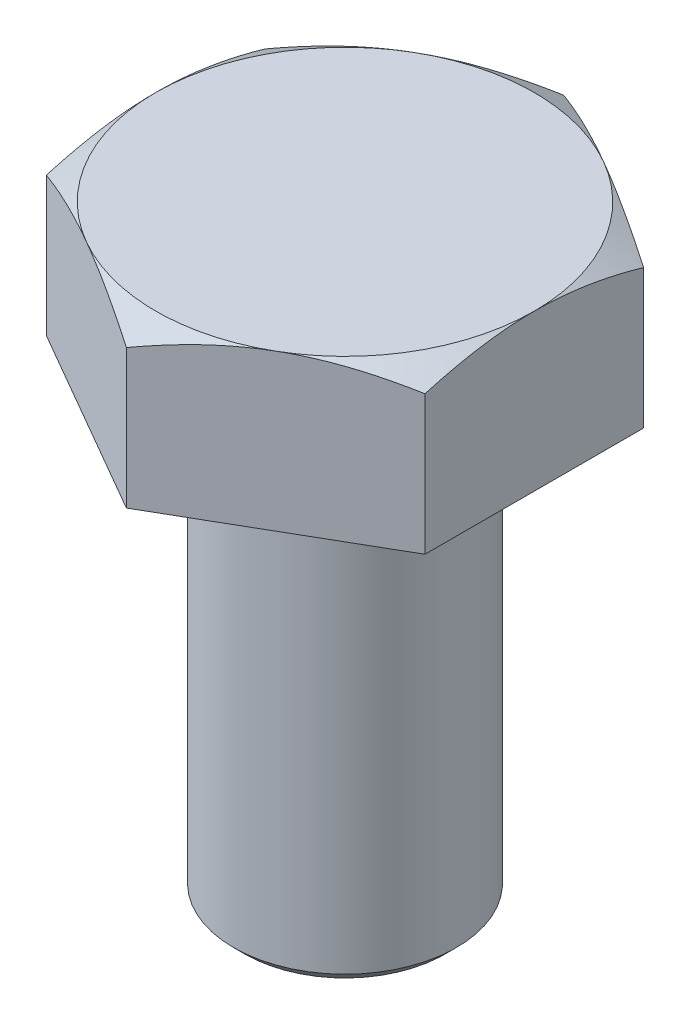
SolidWorks part; units mm, degrees
ref_plane "正面" through (0, 0, 0) normal (0, 0, 1) x (1, 0, 0)
ref_plane "平面" through (0, 0, 0) normal (0, 1, 0) x (1, 0, 0)
ref_plane "右側面" through (0, 0, 0) normal (1, 0, 0) x (0, 0, -1)
sketch "ｽｹｯﾁ1" plane through (0, 0, 0) normal (0, 1, 0) x (1, 0, 0)
  line L0 (0, 0) -> (0, 9.815) construction
  line L1 (0, 9.815) -> (-8.5, 4.9075)
  line L2 (-8.5, 4.9075) -> (-8.5, -4.9075)
  line L3 (-8.5, -4.9075) -> (0, -9.815)
  line L4 (0, -9.815) -> (8.5, -4.9075)
  line L5 (8.5, -4.9075) -> (8.5, 4.9075)
  line L6 (8.5, 4.9075) -> (0, 9.815)
  circle A0 centre (0, 0) radius 8.5 construction
  dimension "D1" = 17
extrude "ﾎﾞｽ - 押し出し1" add sketch "ｽｹｯﾁ1" along normal blind 7
sketch "ｽｹｯﾁ2" plane through (0, 0, 0) normal (1, 0, 0) x (0, 0, -1)
  line L0 (0, 0) -> (0, 7) construction
  line L1 (-4.9075, 7) -> (4.9075, 7) construction
  line L2 (9.815, 7) -> (8.5, 7)
  line L3 (4.9075, 7) -> (9.815, 7) construction
  line L4 (8.5, 7) -> (9.815, 6.2408)
  line L5 (9.815, 7) -> (9.815, 0) construction
  line L6 (9.815, 6.2408) -> (9.815, 7)
  dimension "D1" = 17
  dimension "D2" = 30
revolve "ｶｯﾄ - 回転1" cut sketch "ｽｹｯﾁ2" angle 360 about L0
sketch "ｽｹｯﾁ3" plane through (0, 0, 0) normal (0, 1, 0) x (1, 0, 0)
  circle A0 centre (0, 0) radius 5
  dimension "D1" = 10
extrude "ﾎﾞｽ - 押し出し2" add sketch "ｽｹｯﾁ3" against normal blind 20
chamfer "面取り1" distance 0.5 angle 45 1 edges at (0, -20, 5)
